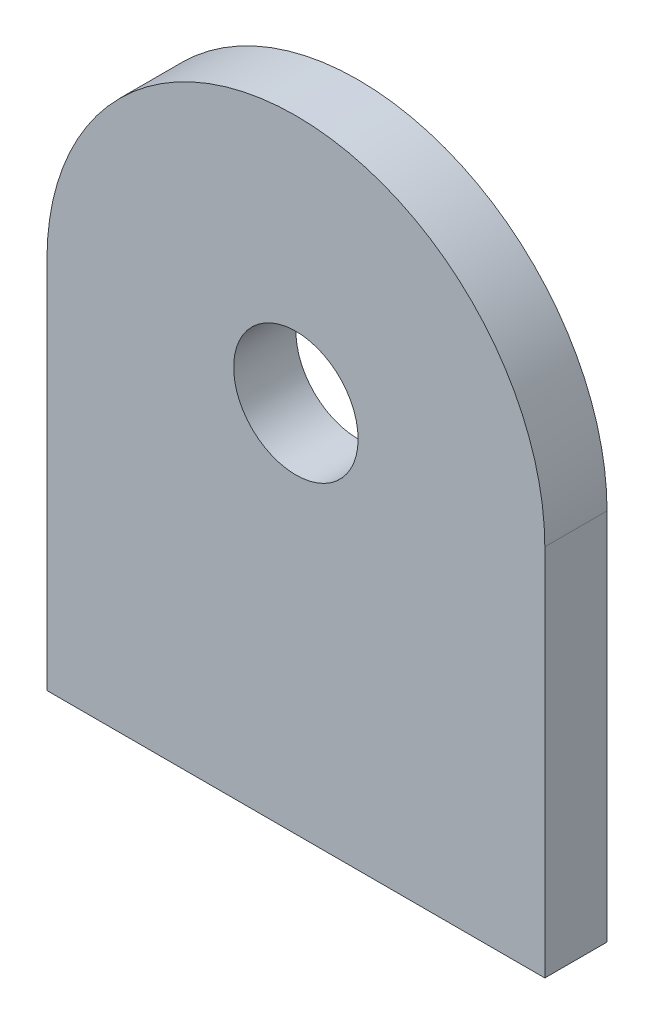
SolidWorks part; units mm, degrees
ref_plane "Front Plane" through (0, 0, 0) normal (0, 0, 1) x (1, 0, 0)
ref_plane "Top Plane" through (0, 0, 0) normal (0, 1, 0) x (1, 0, 0)
ref_plane "Right Plane" through (0, 0, 0) normal (1, 0, 0) x (0, 0, -1)
sketch "Sketch1" plane through (0, 0, 0) normal (0, 0, 1) x (1, 0, 0)
  line L0 (0, 41.5415) -> (0, -35.29) construction
  line L2 (-25.4, 6.35) -> (-25.4, -31.75)
  line L3 (-25.4, -31.75) -> (25.4, -31.75)
  line L4 (25.4, 6.35) -> (25.4, -31.75)
  arc A0 (25.4, 6.35) -> (-25.4, 6.35) centre (0, 6.35) ccw
  point P0 (0, 0)
  dimension "D1" = 25.4
  dimension "D2" = 50.8
  dimension "D3" = 38.1
extrude "Boss-Extrude1" add sketch "Sketch1" along normal mid plane 6.35 contours L2 L3 L4 A0
sketch "Sketch2" plane through (0, 0, 3.175) normal (0, 0, 1) x (1, 0, 0)
  arc A0 (25.4, 6.35) -> (-25.4, 6.35) centre (0, 6.35) ccw construction
  arc A1 (25.4, 6.35) -> (-25.4, 6.35) centre (0, 6.35) ccw construction
  circle A2 centre (0, 6.35) radius 6.35
  dimension "D1" = 12.7
extrude "Cut-Extrude1" cut sketch "Sketch2" against normal through all
